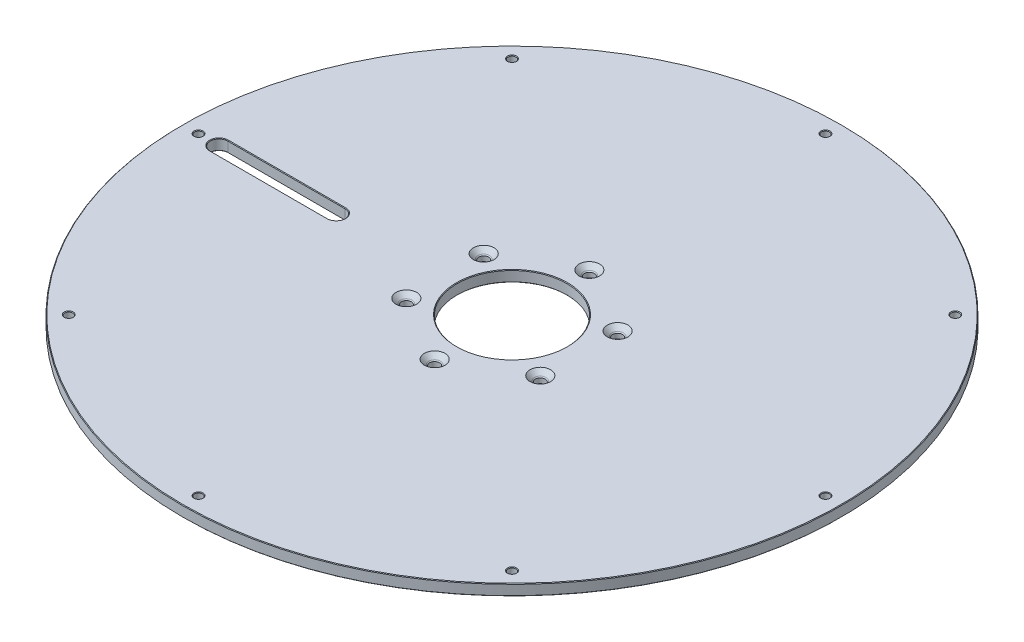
SolidWorks part; units mm, degrees
ref_plane "Front Plane" through (0, 0, 0) normal (0, 0, 1) x (1, 0, 0)
ref_plane "Top Plane" through (0, 0, 0) normal (0, 1, 0) x (1, 0, 0)
ref_plane "Right Plane" through (0, 0, 0) normal (1, 0, 0) x (0, 0, -1)
sketch "Sketch1" plane through (0, 0, 0) normal (0, 0, 1) x (1, 0, 0)
  line L0 (0, 0) -> (0, 40.0271) construction
  line L1 (-23.8125, 0) -> (-142.875, 0)
  line L2 (-142.875, 0) -> (-142.875, -4.7625)
  line L3 (-23.8125, -4.7625) -> (-142.875, -4.7625)
  line L4 (-23.8125, 0) -> (-23.8125, -4.7625)
  dimension "D1" = 285.75
  dimension "D2" = 4.7625
  dimension "D3" = 47.625
revolve "Revolve1" add sketch "Sketch1" angle 360 about L0
sketch "Sketch5" plane through (0, 0, 0) normal (0, 1, 0) x (1, 0, 0)
  line L0 (-76.2, -3.81) -> (-127, -3.81)
  line L1 (-76.2, 3.81) -> (-127, 3.81)
  line L2 (-127, 0) -> (-76.2, 0) construction
  arc A0 (-76.2, -3.81) -> (-76.2, 3.81) centre (-76.2, 0) ccw
  arc A1 (-127, 3.81) -> (-127, -3.81) centre (-127, 0) ccw
  circle A2 centre (0, 0) radius 23.8125 construction
  dimension "D1" = 3.81
  dimension "D2" = 76.2
  dimension "D3" = 127
  dimension "D4" = 3.81
extrude "Cut-Extrude1" cut sketch "Sketch5" against normal through all
hole_wizard "#8-32 Tapped Hole1" positions "Sketch8" profile "Sketch7" tap size "#8-32" standard "ANSI Inch"
sketch "Sketch8" plane through (0, 0, 0) normal (0, 1, 0) x (1, 0, 0)
  line L0 (0, -135.89) -> (0, 0) construction
  point P0 (0, -135.89)
  dimension "D1" = 135.89
sketch "Sketch7" plane through (0, 0, 135.89) normal (1, 0, 0) x (0, 0, 1)
  line L0 (0, 0) -> (0, 12.446)
  line L1 (0, 12.446) -> (1.7272, 12.446)
  line L2 (1.7272, 12.446) -> (1.7272, 0)
  line L5 (1.7272, 0) -> (0, 0)
  line L10 (0, 12.446) -> (-1.7272, 12.446) construction
  line L11 (0, -6.35) -> (0, 107.95) construction
  dimension "Tap Drill Dia." = 3.4544
  dimension "Tap Drill Depth" = 12.446
  dimension "Drill Angle" = 180
pattern_circular "CirPattern1" count 8 over 360 about axis through (0, 0, 0) along (0, 1, 0) of "#8-32 Tapped Hole1"
hole_wizard "CSK for #8 Flat Head Machine Screw1" positions "Sketch10" profile "Sketch9" countersink size "#8" standard "ANSI Inch"
sketch "Sketch10" plane through (0, 0, 0) normal (0, 1, 0) x (1, 0, 0)
  line L0 (0, 28.575) -> (0, 0) construction
  line L1 (0, 0) -> (-29.0361, 16.764) construction
  point P4 (-29.0361, 16.764)
  dimension "D2" = 60
  dimension "D3" = 33.528
sketch "Sketch9" plane through (-29.0361, 0, -16.764) normal (1, 0, 0) x (0, 0, 1)
  line L0 (0, 0) -> (0, 4.7625)
  line L1 (0, 4.7625) -> (2.1526, 4.7625)
  line L2 (2.1526, 4.7625) -> (2.1526, 2.3741)
  line L3 (2.1526, 2.3741) -> (4.2164, 0)
  line L5 (4.2164, 0) -> (0, 0)
  line L6 (-2.1526, 2.3741) -> (-4.2164, 0) construction
  line L11 (0, -6.35) -> (0, 107.95) construction
  dimension "Thru Hole Dia." = 4.3053
  dimension "Thru Hole Depth" = 4.7625
  dimension "Near C'Sink Dia." = 8.4328
  dimension "Near C'Sink Angle" = 82
pattern_circular "CirPattern2" count 6 over 360 about axis through (0, 0, 0) along (0, 1, 0) of "CSK for #8 Flat Head Machine Screw1"
sketch "Sketch11" plane through (0, 0, 0) normal (0, 1, 0) x (1, 0, 0)
  line L0 (0, 0) -> (-20.7873, -22.2917) construction
  line L1 (-13.6339, 0) -> (0, 0) construction
  line L2 (0, 0) -> (-8.9115, -29.1482) construction
  line L3 (0, 0) -> (-29.0361, -16.764) construction
  line L4 (-26.3965, -15.24) -> (0, -30.48) construction
  line L5 (-12.8524, -22.261) -> (0, 0) construction
  line L6 (-29.0361, -16.764) -> (-26.3965, -15.24) construction
  line L7 (0, -30.48) -> (0, 0) construction
  line L8 (-13.1982, -22.86) -> (-12.8524, -22.261) construction
  arc A0 (-10.3076, -33.7147) -> (-7.5154, -24.5816) centre (-8.9115, -29.1482) ccw
  circle A1 centre (0, 0) radius 30.48 construction
  arc A2 (-17.5306, -18.7993) -> (-7.5154, -24.5816) centre (0, 0) ccw
  arc A3 (-24.044, -25.784) -> (-10.3076, -33.7147) centre (0, 0) ccw
  arc A4 (-17.5306, -18.7993) -> (-24.044, -25.784) centre (-20.7873, -22.2917) ccw
  dimension "D3" = 60.96
  dimension "D4" = 4.7752
  dimension "D1" = 26
extrude "Cut-Extrude2" [suppressed] cut sketch "Sketch11" against normal through all
pattern_circular "CirPattern3" [suppressed] count 6 over 360
chamfer "Chamfer1" distance 0.254 angle 45 40 edges at (-101.6, 0, -3.81) (-130.81, 0, 0) (-72.39, 0, 0) (-101.6, 0, 3.81) (0, -4.7625, -142.875) (0, -4.7625, -23.8125) (-72.39, -4.7625, 0) (-101.6, -4.7625, 3.81) (-130.81, -4.7625, 0) (-101.6, -4.7625, -3.81) (0, -4.7625, 137.6172) (-96.0887, -4.7625, 97.8159) (-135.89, -4.7625, 1.7272) (-96.0887, -4.7625, -94.3615) (0, -4.7625, -134.1628) (96.0887, -4.7625, -94.3615) (135.89, -4.7625, 1.7272) (96.0887, -4.7625, 97.8159) (96.0887, 0, 97.8159) (96.0887, 0, -94.3615) (-96.0887, 0, -94.3615) (0, 0, -23.8125) (0, 0, -142.875) (0, 0, 137.6172) (-96.0887, 0, 97.8159) (-135.89, 0, 1.7272) (0, 0, -134.1628) (135.89, 0, 1.7272) (-29.0361, 0, -12.5476) (0, 0, -29.3116) (29.0361, 0, -12.5476) (-29.0361, 0, 20.9804) (29.0361, 0, 20.9804) (0, 0, 37.7444) (-29.0361, -4.7625, -14.6114) (0, -4.7625, -31.3754) (29.0361, -4.7625, -14.6113) (29.0361, -4.7625, 18.9167) (0, -4.7625, 35.6806) (-29.0361, -4.7625, 18.9166)
